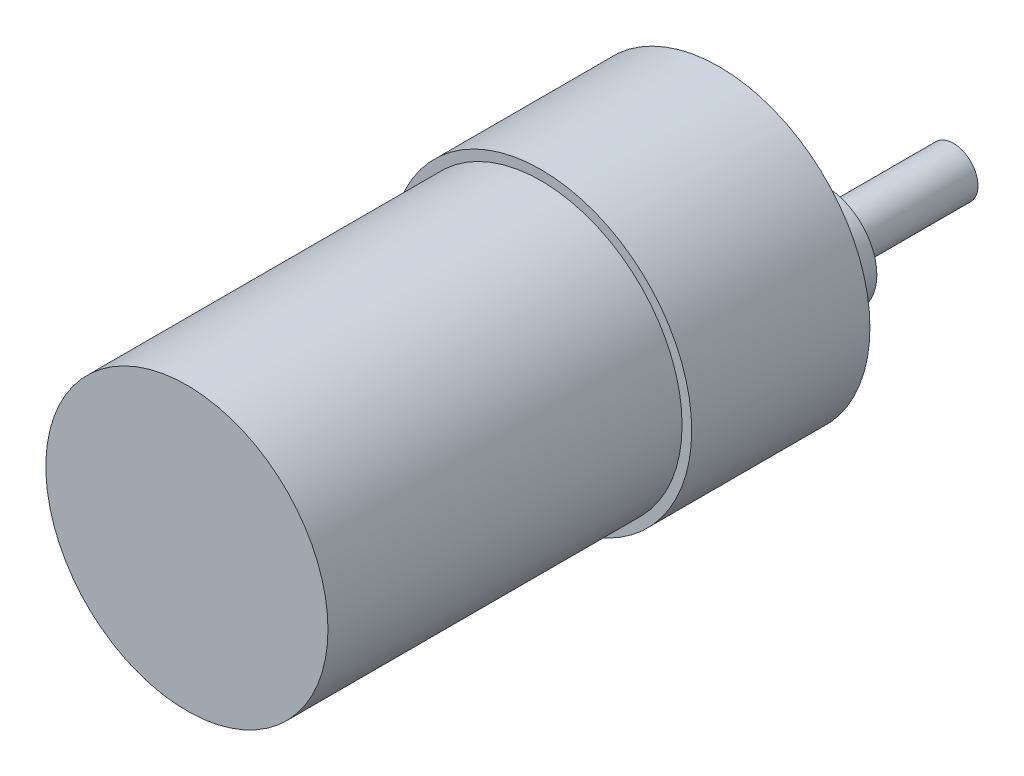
SolidWorks part; units mm, degrees
ref_plane "Front" through (0, 0, 0) normal (0, 0, 1) x (1, 0, 0)
ref_plane "Top" through (0, 0, 0) normal (0, 1, 0) x (1, 0, 0)
ref_plane "Right" through (0, 0, 0) normal (1, 0, 0) x (0, 0, -1)
sketch "Sketch1" plane through (0, 0, 0) normal (0, 0, 1) x (1, 0, 0)
  circle A0 centre (0, 0) radius 15.5 construction
  circle A1 centre (7, 0) radius 6.25
  circle A3 centre (0, 15.5) radius 1.5
  circle A4 centre (13.4234, 7.75) radius 1.5
  circle A5 centre (13.4234, -7.75) radius 1.5
  circle A6 centre (0, -15.5) radius 1.5
  circle A7 centre (-13.4234, -7.75) radius 1.5
  circle A8 centre (-13.4234, 7.75) radius 1.5
  circle A9 centre (0, 0) radius 18.4
  point P3 (0, 15.5)
  point P6 (13.4234, 7.75)
  point P7 (13.4234, -7.75)
  point P8 (0, -15.5)
  point P9 (-13.4234, -7.75)
  point P10 (-13.4234, 7.75)
  point P11 (0, 0)
  point P27 (0, 0)
  dimension "D1" = 31
  dimension "D3" = 12.5
  dimension "D6" = 3
  dimension "D11" = 36.8
  dimension "D4" = 7
  dimension "D2" = 6
  dimension "D10" = 6
sketch "Sketch2" plane through (0, 0, 0) normal (0, 1, 0) x (1, 0, 0)
  line L0 (7, 0) -> (7, 21.6) construction
  line L1 (-17.225, -21.76) -> (-18.4, -21.76)
  line L2 (4, 21.6) -> (10, 21.6)
  line L3 (4, 21.6) -> (4, 6)
  line L4 (4, 6) -> (10, 6)
  line L5 (10, 21.6) -> (10, 6)
  line L6 (0.75, 0) -> (13.25, 0)
  line L7 (0.75, 0) -> (0.75, 6)
  line L8 (0.75, 6) -> (13.25, 6)
  line L9 (13.25, 0) -> (13.25, 6)
  line L10 (17.225, -21.76) -> (18.4, -21.76)
  line L12 (-18.4, 0) -> (18.4, 0)
  line L13 (-18.4, 0) -> (-18.4, -21.76)
  line L15 (18.4, 0) -> (18.4, -21.76)
  line L17 (0, 0) -> (0, -21.76) construction
  line L18 (-17.225, -65) -> (17.225, -65)
  line L19 (-17.225, -65) -> (-17.225, -21.76)
  line L20 (-17.225, -21.76) -> (17.225, -21.76)
  line L21 (17.225, -65) -> (17.225, -21.76)
  dimension "D1" = 15.6
  dimension "D2" = 6
  dimension "D3" = 6
  dimension "D4" = 65
  dimension "D5" = 34.45
  dimension "D6" = 21.76
sketch "Sketch3" plane through (0, 0, 0) normal (0, 0, 1) x (1, 0, 0)
  circle A0 centre (0, 0) radius 18.4 construction
  circle A1 centre (0, 0) radius 18.4
extrude "Boss-Extrude1" add sketch "Sketch3" along normal up to vertex (21.76 mm away)
sketch "Sketch4" plane through (0, 0, 0) normal (0, 0, 1) x (1, 0, 0)
  circle A0 centre (0, 0) radius 17.225
extrude "Boss-Extrude2" add sketch "Sketch4" along normal up to vertex (65 mm away)
sketch "Sketch5" plane through (0, 0, 0) normal (0, 1, 0) x (1, 0, 0)
  line L0 (4, 21.6) -> (10, 21.6) construction
  line L1 (4, 21.6) -> (4, 6) construction
  line L2 (0.75, 6) -> (13.25, 6) construction
  line L3 (0.75, 0) -> (0.75, 6) construction
  line L4 (0.75, 0) -> (13.25, 0) construction
  line L5 (4, 21.6) -> (7, 21.6)
  line L6 (4, 21.6) -> (4, 6)
  line L7 (0.75, 6) -> (4, 6)
  line L8 (0.75, 0) -> (0.75, 6)
  line L9 (0.75, 0) -> (7, 0)
  line L10 (7, 0) -> (7, 21.6) construction
  line L11 (7, 0) -> (7, 21.6)
revolve "Revolve1" add sketch "Sketch5" angle 360 about L11
hole_wizard "M3x0.5 Tapped Hole1" positions "Sketch7" profile "Sketch6" tap size "M3x0.5" standard "ANSI Metric"
sketch "Sketch7" plane through (0, 0, 0) normal (0, 0, -1) x (-1, 0, 0)
  point P0 (13.4234, 7.75)
  point P3 (0, 15.5)
  point P6 (-13.4234, 7.75)
  point P9 (-13.4234, -7.75)
  point P12 (0, -15.5)
  point P15 (13.4234, -7.75)
sketch "Sketch6" plane through (-13.4234, 7.75, 0) normal (1, 0, 0) x (0, 1, 0)
  line L0 (0, 0) -> (0, 4.7511)
  line L1 (0, 4.7511) -> (1.25, 4)
  line L2 (1.25, 4) -> (1.25, 3.5)
  line L3 (1.25, 3.5) -> (1.5, 3.5)
  line L4 (1.5, 3.5) -> (1.5, 0)
  line L5 (1.5, 0) -> (0, 0)
  line L10 (0, 4.7511) -> (-1.25, 4) construction
  line L11 (0, -6.35) -> (0, 107.95) construction
  dimension "Tap Drill Dia." = 2.5
  dimension "Tap Drill Depth" = 4
  dimension "Thread Major Dia." = 3
  dimension "Thread Depth" = 3.5
  dimension "Drill Angle" = 118
other "Center of Mass Reference Point1"
